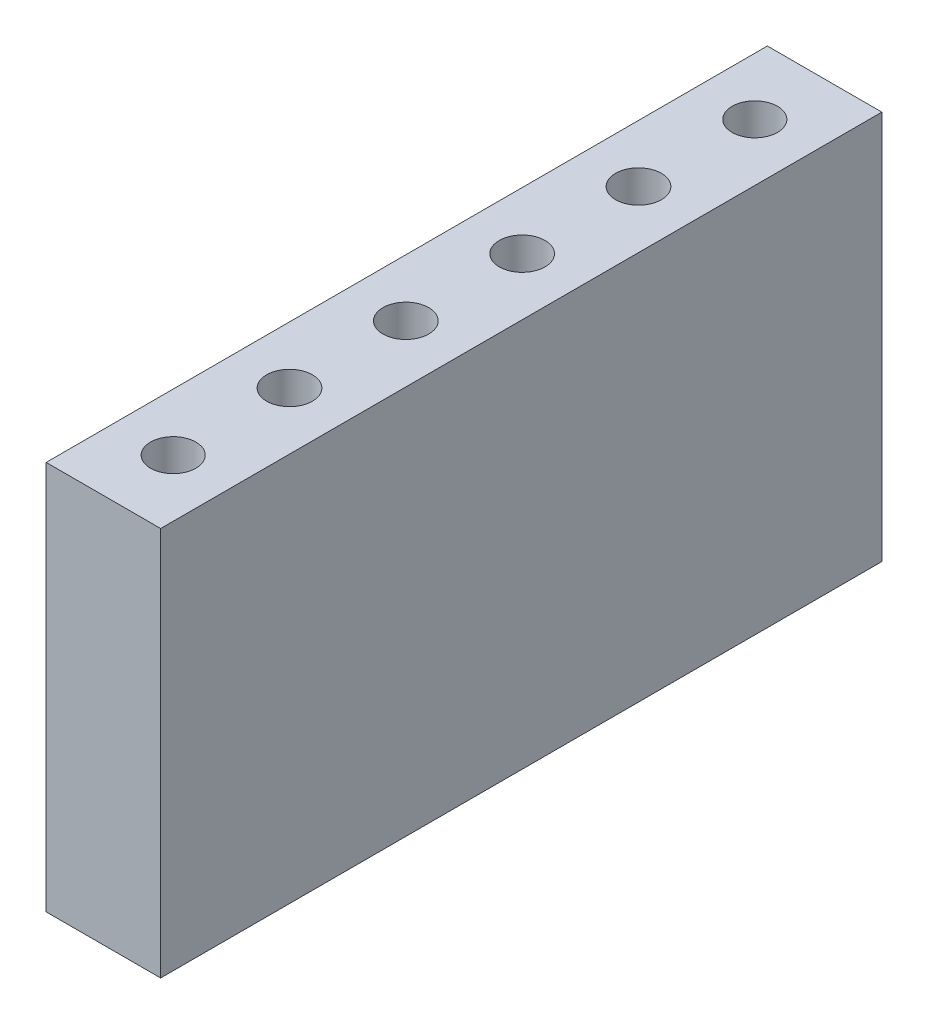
SolidWorks part; units mm, degrees
ref_plane "Front Plane" through (0, 0, 0) normal (0, 0, 1) x (1, 0, 0)
ref_plane "Top Plane" through (0, 0, 0) normal (0, 1, 0) x (1, 0, 0)
ref_plane "Right Plane" through (0, 0, 0) normal (1, 0, 0) x (0, 0, -1)
sketch "Sketch1" plane through (0, 0, 0) normal (0, 1, 0) x (1, 0, 0)
  line L0 (1.25, 15.748) -> (1.25, 0) construction
  line L1 (0, 0) -> (2.5, 0)
  line L2 (0, 0) -> (0, 15.748)
  line L3 (0, 15.748) -> (2.5, 15.748)
  line L4 (2.5, 0) -> (2.5, 15.748)
  line L5 (0, 7.874) -> (2.5, 7.874) construction
  dimension "D1" = 15.748
  dimension "D2" = 2.5
extrude "Extrude1" add sketch "Sketch1" along normal blind 8.5
sketch "Sketch2" plane through (0, 8.5, 0) normal (0, 1, 0) x (-1, 0, 0)
  line L0 (-1.25, 0) -> (-1.25, -15.748) construction
  line L1 (0, 0) -> (-2.5, 0) construction
  line L2 (-2.5, -15.748) -> (0, -15.748) construction
  line L3 (-2.5, -7.874) -> (0, -7.874) construction
  line L4 (-2.5, 0) -> (-2.5, -15.748) construction
  line L5 (0, -15.748) -> (0, 0) construction
  circle A0 centre (-1.25, -6.604) radius 0.5
  circle A1 centre (-1.25, -4.064) radius 0.5
  circle A2 centre (-1.25, -1.524) radius 0.4953
  circle A3 centre (-1.25, -14.224) radius 0.4953
  circle A6 centre (-1.25, -11.684) radius 0.5
  circle A7 centre (-1.25, -9.144) radius 0.5
  circle A8 centre (-1.25, 1.016) radius 0.5
  circle A9 centre (-1.25, -1.524) radius 0.5
  dimension "D1" = 1
  dimension "D4" = 0.9906
  dimension "D2" = 2.54
  dimension "D3" = 2.54
  dimension "D5" = 2.54
extrude "Cut-Extrude1" cut sketch "Sketch2" against normal blind 6.38
sketch "Sketch3" plane through (0, 0, 0) normal (0, -1, 0) x (1, 0, 0)
  circle A0 centre (1.25, -1.524) radius 0.4953 construction
  point P0 (1.25, -1.524)
